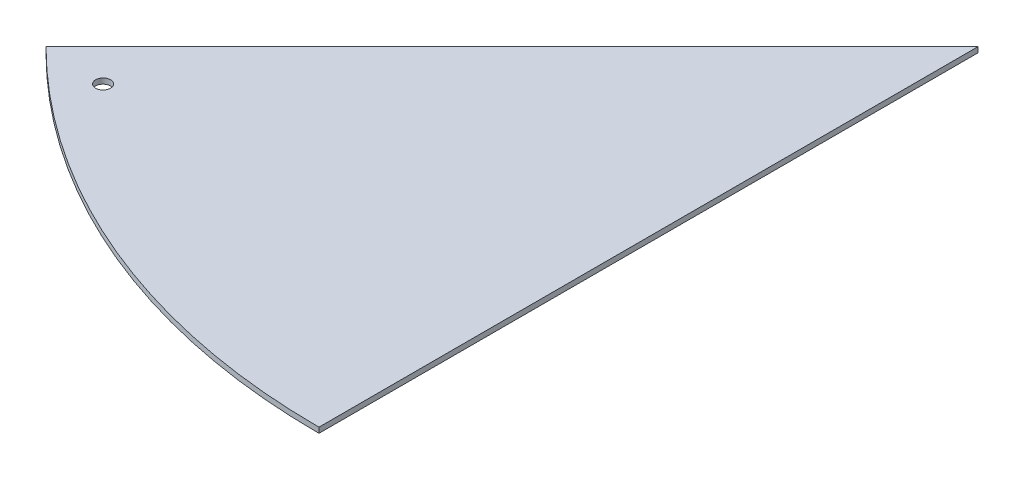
SolidWorks part; units mm, degrees
ref_plane "Front Plane" through (0, 0, 0) normal (0, 0, 1) x (1, 0, 0)
ref_plane "Top Plane" through (0, 0, 0) normal (0, 1, 0) x (1, 0, 0)
ref_plane "Right Plane" through (0, 0, 0) normal (1, 0, 0) x (0, 0, -1)
sketch "Sketch2" plane through (0, 0, 0) normal (0, 1, 0) x (1, 0, 0)
  line L0 (0, 0) -> (0, -2450)
  line L1 (0, 0) -> (-1732.4116, -1732.4116)
  arc A0 (-1732.4116, -1732.4116) -> (0, -2450) centre (0, 0) ccw
  dimension "D1" = 4900
  dimension "D2" = 45
extrude "Boss-Extrude1" add sketch "Sketch2" along normal blind 20
sketch "Sketch3" plane through (0, 20, 0) normal (0, 1, 0) x (1, 0, 0)
  line L0 (-1732.4116, -1732.4116) -> (-1626.3456, -1626.3456) construction
  line L1 (0, 0) -> (-1732.4116, -1732.4116) construction
  line L2 (-1732.4116, -1732.4116) -> (-1612.2035, -1852.6198) construction
  circle A0 centre (-1506.1374, -1746.5537) radius 27.5
  dimension "D1" = 55
  dimension "D2" = 150
  dimension "D3" = 170
  dimension "D4" = 170
  dimension "D5" = 150
extrude "Cut-Extrude1" cut sketch "Sketch3" against normal through all
